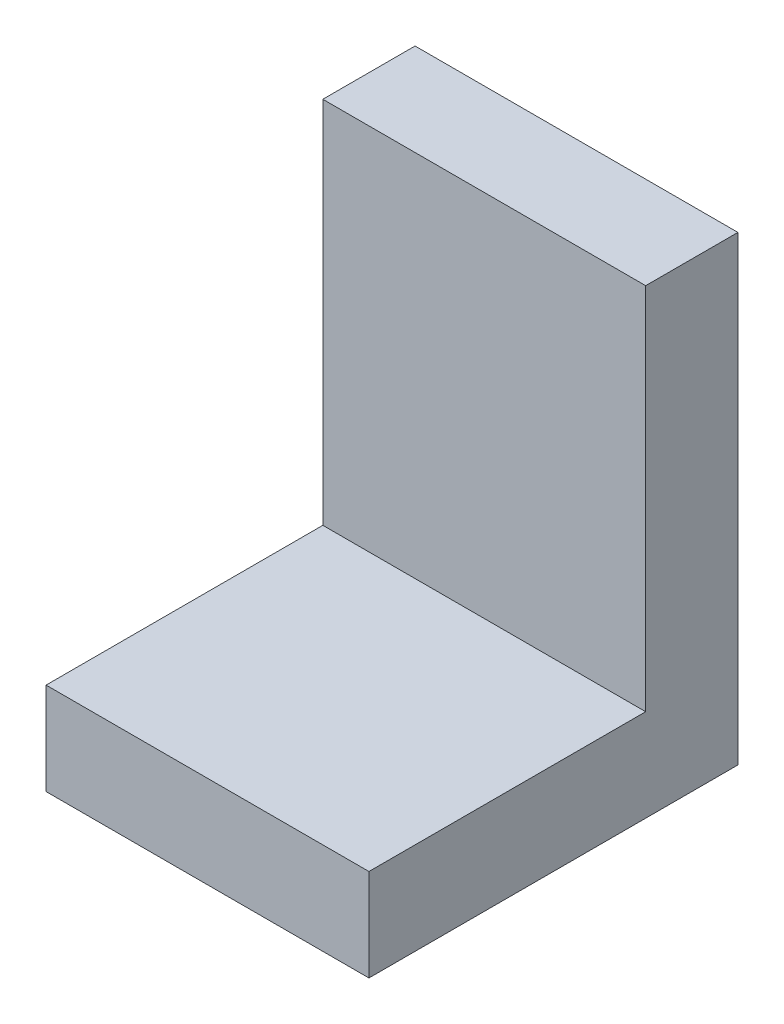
SolidWorks part; units mm, degrees
ref_plane "Front Plane" through (0, 0, 0) normal (0, 0, 1) x (1, 0, 0)
ref_plane "Top Plane" through (0, 0, 0) normal (0, 1, 0) x (1, 0, 0)
ref_plane "Right Plane" through (0, 0, 0) normal (1, 0, 0) x (0, 0, -1)
sketch "Sketch1" plane through (0, 0, 0) normal (1, 0, 0) x (0, 0, -1)
  line L0 (0, 0) -> (-76.2, 0)
  line L1 (0, 0) -> (0, 101.6)
  dimension "D1" = 101.6
  dimension "D2" = 76.2
extrude "Extrude-Thin1" add sketch "Sketch1" along normal mid plane 88.9 thin
